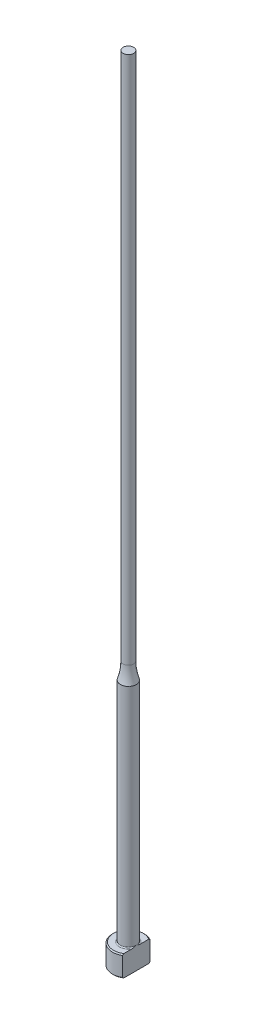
SolidWorks part; units mm, degrees
ref_plane "Front Plane" through (0, 0, 0) normal (0, 0, 1) x (1, 0, 0)
ref_plane "Top Plane" through (0, 0, 0) normal (0, 1, 0) x (1, 0, 0)
ref_plane "Right Plane" through (0, 0, 0) normal (1, 0, 0) x (0, 0, -1)
sketch "Sketch1" plane through (0, 0, 0) normal (0, 0, 1) x (1, 0, 0)
  line L0 (0, 259.9588) -> (0, -15.1925) construction
  line L1 (0, 0) -> (-3, 0)
  line L2 (-3, 0) -> (-3, 4)
  line L3 (-3, 4) -> (-1.5, 4)
  line L4 (-1, 50) -> (-1, 150)
  line L5 (-1, 150) -> (0, 150)
  line L6 (0, 150) -> (0, 0)
  line L7 (-1.5, 4) -> (-1.5, 46.8775)
  arc A0 (-1.5, 46.8775) -> (-1, 50) centre (-11, 50) ccw
  point P13 (-1.5, 0)
  dimension "D1" = 10
  dimension "L" = 150
  dimension "H" = 6
  dimension "T" = 4
  dimension "D" = 2
  dimension "B" = 3
  dimension "S" = 50
revolve "Revolve1" add sketch "Sketch1" angle 360 about L0
chamfer "Chamfer1" distance 0.2 angle 45 2 edges at (0, 4, 3) (0, 0, 3)
fillet "Fillet1" radius 0.2 1 edges at (0, 4, 1.5)
sketch "Sketch2" plane through (0, 0, 0) normal (0, 1, 0) x (1, 0, 0)
  line L0 (1.5, -2.5981) -> (1.5, 2.5981)
  circle A0 centre (0, 0) radius 3 construction
  arc A1 (1.5, -2.5981) -> (1.5, 2.5981) centre (0, 0) ccw
  circle A2 centre (0, 0) radius 1.5 construction
extrude "Keyed Head" cut sketch "Sketch2" along normal through all
